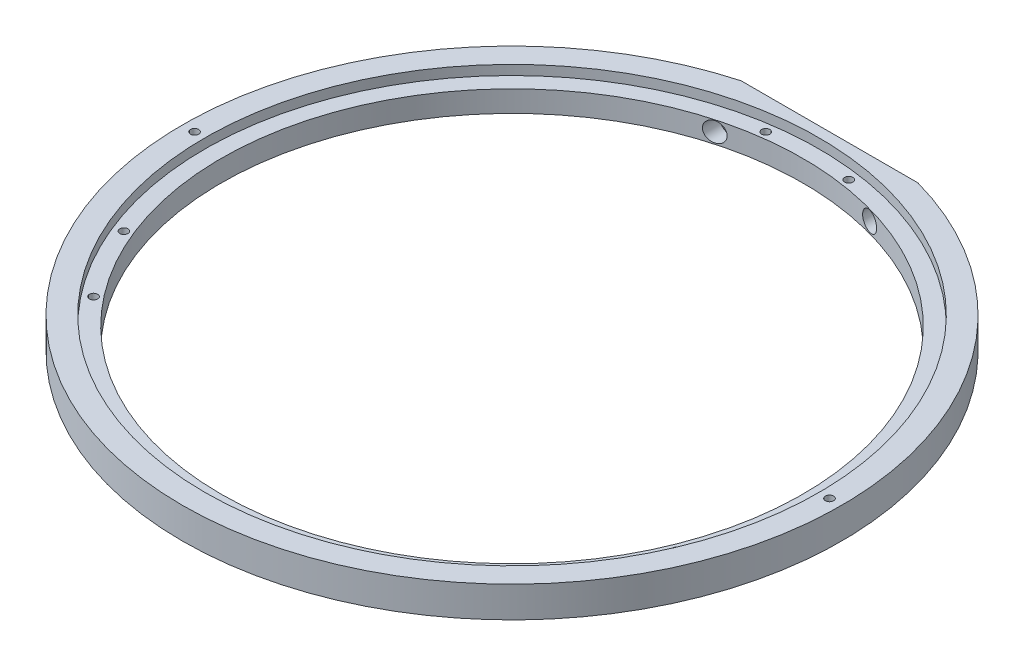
SolidWorks part; units mm, degrees
ref_plane "Front Plane" through (0, 0, 0) normal (0, 0, 1) x (1, 0, 0)
ref_plane "Top Plane" through (0, 0, 0) normal (0, 1, 0) x (1, 0, 0)
ref_plane "Right Plane" through (0, 0, 0) normal (1, 0, 0) x (0, 0, -1)
sketch "Sketch1" plane through (0, 0, 0) normal (0, 1, 0) x (1, 0, 0)
  line L0 (0, 287.0189) -> (0, -287.0189) construction
  line L1 (0, 0) -> (338.45, -195.4042) construction
  line L2 (0, 0) -> (-300.5904, -173.546) construction
  circle A0 centre (0, 0) radius 238.506
  circle A1 centre (0, 0) radius 270.256
  dimension "D1" = 31.75
  dimension "D2" = 477.012
  dimension "D3" = 120
  dimension "D4" = 120
extrude "Extrude1" add sketch "Sketch1" against normal blind 25.4
sketch "Sketch2" plane through (0, 0, 0) normal (0, 1, 0) x (-1, 0, 0)
  line L0 (0, 0) -> (-43.0147, -306.0653) construction
  line L1 (0, 0) -> (42.9222, -305.4073) construction
  line L2 (0, -287.0189) -> (0, 287.0189) construction
  circle A0 centre (34.0243, -242.0958) radius 3.3782
  dimension "D3" = 244.475
  dimension "D1" = 8
  dimension "D2" = 8
extrude "Cut-Extrude1" cut sketch "Sketch2" against normal through all
mirror "Mirror1" about plane through (0, 0, 0) normal (1, 0, 0) of "Cut-Extrude1"
pattern_circular "CirPattern1" count 3 over 360 about axis through (0, 0, 0) along (0, 1, 0) of "Cut-Extrude1", "Mirror1"
sketch "Sketch3" plane through (0, 0, 0) normal (0, 1, 0) x (-1, 0, 0)
  circle A0 centre (0, 0) radius 251.841
extrude "Cut-Extrude2" cut sketch "Sketch3" against normal blind 7.9248
sketch "Sketch4" plane through (0, 0, 0) normal (0, 1, 0) x (-1, 0, 0)
  line L0 (286.355, 0) -> (-289.7982, 0) construction
  circle A0 centre (260.35, 0) radius 3.3782
  dimension "D1" = 260.35
extrude "Cut-Extrude3" cut sketch "Sketch4" against normal through all
mirror "Mirror2" about plane through (0, 0, 0) normal (1, 0, 0) of "Cut-Extrude3"
sketch "Sketch5" plane through (0, 0, 0) normal (0, 1, 0) x (1, 0, 0)
  line L1 (-107.5383, 297.4773) -> (100.6083, 297.4773)
  line L2 (-107.5383, 297.4773) -> (-107.5383, 260.35)
  line L3 (-107.5383, 260.35) -> (100.6083, 260.35)
  line L4 (100.6083, 297.4773) -> (100.6083, 260.35)
  dimension "D1" = 260.35
extrude "Cut-Extrude4" cut sketch "Sketch5" against normal through all
sketch "Sketch6" plane through (0, 0, -260.35) normal (0, 0, -1) x (-1, 0, 0)
  line L0 (72.4995, -25.4) -> (-72.4995, -25.4) construction
  circle A0 centre (63.5, -16.51) radius 3.3782
  dimension "D1" = 8.89
  dimension "D2" = 63.5
extrude "Cut-Extrude5" cut sketch "Sketch6" against normal blind 35.56
ref_plane "Plane1" through (0, 0, -213.36) normal (0, 0, 1) x (1, 0, 0)
sketch "Sketch7" plane through (0, 0, -213.36) normal (0, 0, 1) x (1, 0, 0)
  circle A0 centre (-63.5, -16.51) radius 7.9375
extrude "Cut-Extrude6" cut sketch "Sketch7" against normal blind 28.575
mirror "Mirror3" about plane through (0, 0, 0) normal (1, 0, 0) of "Cut-Extrude5", "Cut-Extrude6"
